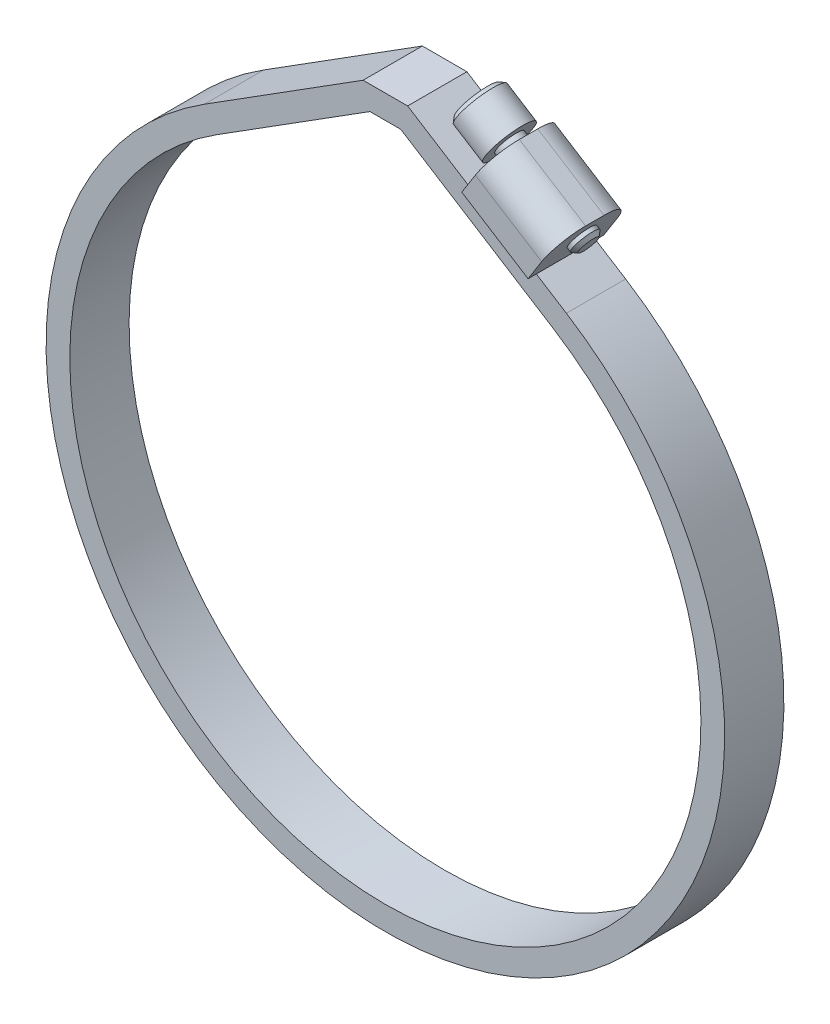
SolidWorks part; units mm, degrees
ref_plane "Front" through (0, 0, 0) normal (0, 0, 1) x (1, 0, 0)
ref_plane "Top" through (0, 0, 0) normal (0, 1, 0) x (1, 0, 0)
ref_plane "Right" through (0, 0, 0) normal (1, 0, 0) x (0, 0, -1)
sketch "Sketch1" plane through (0, 0, 0) normal (0, 0, 1) x (1, 0, 0)
  line L0 (-24.04, 38.111) -> (-2.9575, 51.4096)
  line L1 (-2.9575, 51.4096) -> (2.9575, 51.4096)
  line L2 (2.9575, 51.4096) -> (24.04, 38.111)
  line L3 (0, 0) -> (0, 51.4096) construction
  line L4 (-2.9676, 50.6825) -> (-23.7148, 37.5954)
  line L5 (-2.561, 50.8) -> (2.561, 50.8)
  line L6 (2.9676, 50.6825) -> (23.7148, 37.5954)
  arc A0 (-23.7148, 37.5954) -> (23.7148, 37.5954) centre (0, 0) ccw
  arc A1 (-24.04, 38.111) -> (24.04, 38.111) centre (0, 0) ccw
  arc A2 (-2.561, 50.8) -> (-2.9676, 50.6825) centre (-2.561, 50.038) ccw
  arc A3 (2.561, 50.8) -> (2.9676, 50.6825) centre (2.561, 50.038) cw
  point P11 (-2.7813, 50.8)
  point P16 (2.7813, 50.8)
  dimension "D1" = 88.9
  dimension "D2" = 0.6096
  dimension "D6" = 6.35
  dimension "D7" = 0.762
  dimension "D8" = 0.762
  dimension "D3" = 0.6096
  dimension "D4" = 5.5626
  dimension "D5" = 0.6096
extrude "Extrude1" add sketch "Sketch1" against normal mid plane 7.874
sketch "Sketch4" plane through (0, 0, 0) normal (0, 0, 1) x (1, 0, 0)
  line L0 (8.2443, 52.8196) -> (-9.0904, 63.7542) construction
  line L1 (24.04, 38.111) -> (2.9575, 51.4096) construction
  line L2 (8.2443, 52.8196) -> (6.5504, 50.1343)
  line L3 (6.5504, 50.1343) -> (10.847, 47.424)
  line L4 (10.847, 47.424) -> (11.6093, 48.6324)
  line L5 (11.6093, 48.6324) -> (22.1038, 42.0126)
  line L6 (22.1038, 42.0126) -> (23.0354, 43.4896)
  line L7 (8.2443, 52.8196) -> (23.0354, 43.4896)
  line L8 (13.4988, 44.7603) -> (10.6801, 40.2918) construction
  dimension "D1" = 3.4925
  dimension "D2" = 6.35
  dimension "D3" = 5.08
  dimension "D4" = 12.4079
  dimension "D5" = 4.0132
revolve "Revolve1" add sketch "Sketch4" angle 360 about L0
sketch "Sketch5" plane through (0, 0, 0) normal (0, 0, 1) x (1, 0, 0)
  line L0 (11.2456, 46.1815) -> (15.0806, 52.2612)
  line L1 (24.04, 38.111) -> (2.9575, 51.4096) construction
  line L2 (15.0806, 52.2612) -> (23.8835, 46.7085)
  line L3 (23.8835, 46.7085) -> (20.0485, 40.6288)
  line L4 (10.847, 47.424) -> (14.2348, 52.7948) construction
  line L5 (22.1038, 42.0126) -> (23.9671, 44.9665) construction
  line L6 (14.2348, 52.7948) -> (9.9382, 55.505) construction
  line L7 (11.2456, 46.1815) -> (20.0485, 40.6288)
  dimension "D1" = 1
  dimension "D2" = 1
extrude "Extrude3" add sketch "Sketch5" along normal mid plane 10.0584 separate body
fillet "Fillet1" radius 3.81 2 edges at (19.4821, 49.4849, -5.0292) (19.4821, 49.4849, 5.0292)
chamfer "Chamfer1" distance 0.5 angle 45 2 edges at (23.9671, 44.9665, 0) (9.9382, 55.505, 0)
sketch "Sketch6" plane through (-17.9368, 11.3144, 0) normal (-0.8458, 0.5335, 0) x (0, 0, 1)
  line L0 (-3.937, 41.9039) -> (-3.937, 19.4081) construction
  line L1 (0, 51.3822) -> (-2, 50.2275)
  line L2 (-2, 50.2275) -> (-2, 47.9181)
  line L3 (-2, 47.9181) -> (0, 46.7634)
  line L4 (0, 46.7634) -> (2, 47.9181)
  line L5 (2, 47.9181) -> (2, 50.2275)
  line L6 (2, 50.2275) -> (0, 51.3822)
  circle A0 centre (0, 49.0728) radius 2 construction
  circle A1 centre (0, 49.0728) radius 2.675 construction
  dimension "D1" = 4
extrude "Cut-Extrude1" cut sketch "Sketch6" against normal blind 2.5
sketch "Sketch7" plane through (0, 0, 3.937) normal (0, 0, 1) x (1, 0, 0)
  line L0 (23.7148, 37.5954) -> (2.9676, 50.6825) construction
  line L1 (-2.9676, 50.6825) -> (-23.7148, 37.5954) construction
  line L2 (2.561, 50.8) -> (-2.561, 50.8) construction
  line L3 (23.7148, 37.5954) -> (2.9676, 50.6825)
  line L4 (-2.9676, 50.6825) -> (-23.7148, 37.5954)
  line L5 (2.561, 50.8) -> (-2.561, 50.8)
  line L6 (-2.0471, 48.26) -> (-22.3597, 35.4471)
  line L7 (22.3597, 35.4471) -> (2.0471, 48.26)
  line L8 (2.0471, 48.26) -> (-2.0471, 48.26)
  arc A0 (-23.7148, 37.5954) -> (23.7148, 37.5954) centre (0, 0) ccw construction
  arc A1 (2.9676, 50.6825) -> (2.561, 50.8) centre (2.561, 50.038) ccw construction
  arc A2 (-2.561, 50.8) -> (-2.9676, 50.6825) centre (-2.561, 50.038) ccw construction
  arc A3 (-23.7148, 37.5954) -> (23.7148, 37.5954) centre (0, 0) ccw
  arc A4 (2.9676, 50.6825) -> (2.561, 50.8) centre (2.561, 50.038) ccw
  arc A5 (-2.561, 50.8) -> (-2.9676, 50.6825) centre (-2.561, 50.038) ccw
  arc A6 (-22.3597, 35.4471) -> (22.3597, 35.4471) centre (0, 0) ccw
  arc A7 (2.0471, 48.26) -> (2.0471, 48.26) centre (2.0471, 48.26) ccw
  arc A8 (-2.0471, 48.26) -> (-2.0471, 48.26) centre (-2.0471, 48.26) ccw
  dimension "D1" = 2.54
extrude "Web-Extrude4" add sketch "Sketch7" against normal up to surface (7.874 mm away)
